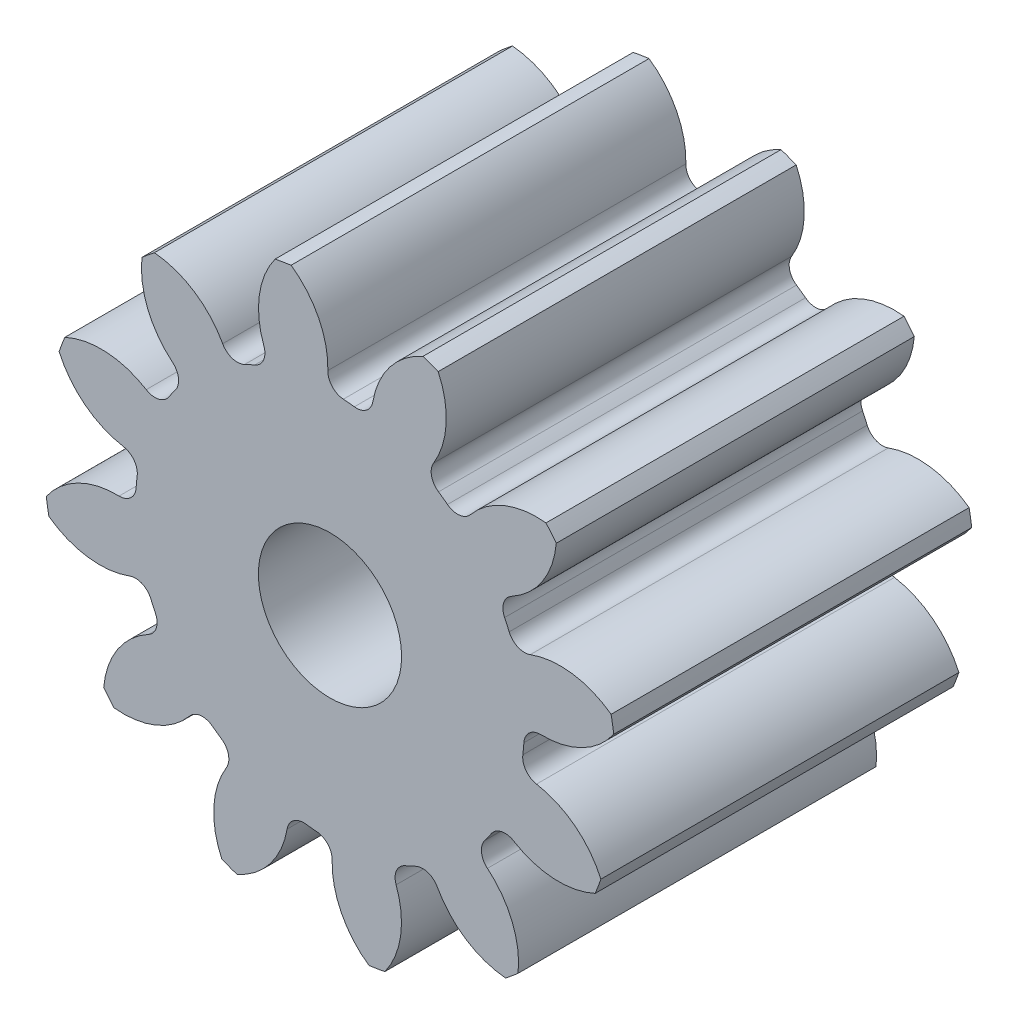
SolidWorks part; units mm, degrees
ref_plane "Front" through (0, 0, 0) normal (0, 0, 1) x (1, 0, 0)
ref_plane "Top" through (0, 0, 0) normal (0, 1, 0) x (1, 0, 0)
ref_plane "Right" through (0, 0, 0) normal (1, 0, 0) x (0, 0, -1)
sketch "Sketch3" plane through (0, 0, 0) normal (0, 0, 1) x (1, 0, 0)
  circle A0 centre (0, 0) radius 71.12
  dimension "od" = 142.24
extrude "gearBody" add sketch "Sketch3" along normal blind 88.9
sketch "Sketch2" plane through (0, 0, 0) normal (0, 0, 1) x (1, 0, 0)
  line L0 (0, 0) -> (52.9232, 21.9215) construction
  line L1 (67.7157, -24.2146) -> (0, 0) construction
  line L2 (0, 0) -> (36.3143, 0) construction
  line L3 (60.9246, 2.076) -> (59.3733, -13.8178) construction
  line L5 (60.149, -5.8709) -> (0, 0) construction
  line L7 (0, 0) -> (57.2837, 0) construction
  arc A0 (57.2754, 0.9709) -> (56.0067, -12.0279) centre (0, 0) ccw construction
  arc A1 (70.4607, 9.6616) -> (67.2625, -23.1042) centre (0, 0) ccw construction
  arc A2 (60.9246, 2.076) -> (59.3733, -13.8178) centre (0, 0) ccw construction
  arc A3 (47.8788, -6.0538) -> (48.1458, -3.3188) centre (0, 0) ccw
  arc A4 (67.7157, -24.2146) -> (51.2855, -10.6487) centre (47.6854, -31.7415) ccw
  arc A5 (67.7157, -24.2146) -> (71.12, 10.6634) centre (0, 0) ccw
  arc A6 (71.12, 10.6634) -> (52.3767, 0.5306) centre (52.9232, 21.9215) cw
  arc A7 (48.1458, -3.3188) -> (52.3767, 0.5306) centre (52.2711, -3.6031) cw
  arc A8 (51.2855, -10.6487) -> (47.8788, -6.0538) centre (51.9813, -6.5725) cw
  point P6 (71.12, 10.6634)
  point P22 (67.7157, -24.2146)
  dimension "baseDia" = 114.5673
  dimension "od" = 142.24
  dimension "pd" = 121.92
  dimension "rd" = 96.52
  dimension "rFillet" = 4.1351
  dimension "pointX" = 71.12
  dimension "pointY" = 10.6634
  dimension "CTT" = 15.8937
  dimension "flankCenterAngle" = 22.5
extrude "toothCut" cut sketch "Sketch2" along normal through all
pattern_circular "CirPattern1" count 12 over 360 about axis through (0, 0, 0) along (0, 0, 1) of "toothCut"
sketch "hub1Dia" plane through (0, 0, 0) normal (0, 0, -1) x (-1, 0, 0)
  circle A0 centre (0, 0) radius 12.7
  dimension "hub1Dia" = 25.4
sketch "hub2Dia" plane through (0, 0, 88.9) normal (0, 0, 1) x (1, 0, 0)
  circle A0 centre (0, 0) radius 12.7
  dimension "hub2dia" = 25.4
sketch "boreDia" plane through (0, 0, 0) normal (0, 0, 1) x (1, 0, 0)
  circle A0 centre (0, 0) radius 17.78
  dimension "boreDia" = 35.56
extrude "bore" cut sketch "boreDia" against normal mid plane 25400
